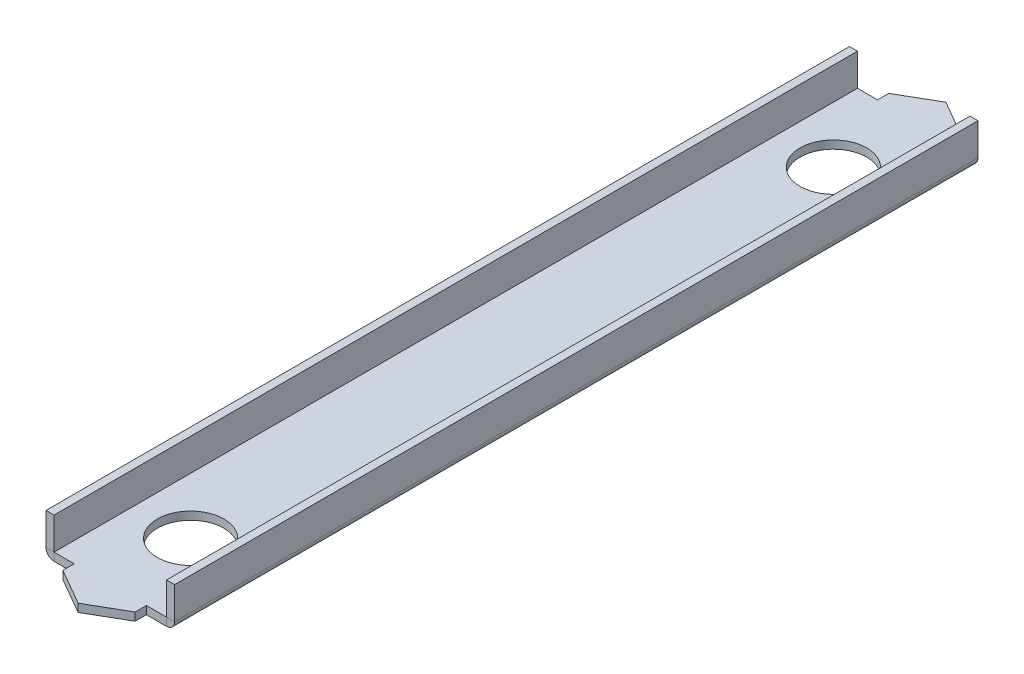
SolidWorks part; units mm, degrees
ref_plane "Plan1" through (0, 0, 0) normal (0, 0, 1) x (1, 0, 0)
ref_plane "Plan2" through (0, 0, 0) normal (0, 1, 0) x (1, 0, 0)
ref_plane "Plan3" through (0, 0, 0) normal (1, 0, 0) x (0, 0, -1)
sketch "Esquisse1" plane through (0, 0, 0) normal (0, 0, 1) x (1, 0, 0)
  line L0 (-8, 0) -> (8, 0)
  line L1 (8, 0) -> (8, 5)
  line L2 (0, 30) -> (0, -30) construction
  line L3 (-8, 0) -> (-8, 5)
  point P7 (0, 0)
  dimension "D1" = 16
  dimension "D2" = 5
extrude "Base-Extru.-Mince" add sketch "Esquisse1" along normal mid plane 110 thin
sheet metal parameters "Tôlerie 1" parameters "D1"=0
bend "Pli dans angle2" bend angle 90 parameters "D1"=0, "D5"=1
flatten bends "Dépliage 1" parameters "D1"=0
sketch "Esquisse-Angle1" plane through (0, 1, 0) normal (0, 1, 0) x (-1, 0, 0)
  line L0 (-7.3927, 55) -> (-7.3927, -55) construction
  line L1 (7.3927, -55) -> (7.3927, 55) construction
bend "Pli dans angle1" bend angle 90 parameters "D1"=0, "D5"=2
sketch "Esquisse5" plane through (0, 0, 0) normal (0, 1, 0) x (1, 0, 0)
  line L0 (51, 0) -> (-54, 0) construction
  line L1 (0, 70) -> (0, -47) construction
  line L2 (0, 54) -> (4.5, 51.4019)
  line L3 (4.5, 51.4019) -> (4.5, 50)
  line L4 (4.5, 50) -> (11.7854, 50)
  line L5 (11.7854, -55) -> (11.7854, 55) construction
  line L6 (11.7854, 50) -> (11.7854, 55)
  line L7 (11.7854, 55) -> (-11.7854, 55)
  line L8 (-4.5, 51.4019) -> (-4.5, 50)
  line L9 (0, 54) -> (-4.5, 51.4019)
  line L10 (-11.7854, 50) -> (-11.7854, 55)
  line L11 (-4.5, 50) -> (-11.7854, 50)
  line L12 (-11.7854, -55) -> (-11.7854, 55) construction
  line L13 (0, -54) -> (4.5, -51.4019)
  line L14 (4.5, -51.4019) -> (4.5, -50)
  line L15 (0, -54) -> (-4.5, -51.4019)
  line L16 (-4.5, -51.4019) -> (-4.5, -50)
  line L17 (-4.5, -50) -> (-11.7854, -50)
  line L18 (-11.7854, -50) -> (-11.7854, -55)
  line L19 (11.7854, -55) -> (-11.7854, -55)
  line L20 (11.7854, -50) -> (11.7854, -55)
  line L21 (4.5, -50) -> (11.7854, -50)
  circle A0 centre (0, 40) radius 4.15
  circle A1 centre (0, -40) radius 4.15
  point P21 (0, 55)
  dimension "D1" = 8.3
  dimension "D2" = 40
  dimension "D3" = 1
  dimension "D4" = 4
  dimension "D5" = 4.5
  dimension "D6" = 60
extrude "Enlèv. mat.-Extru.4" cut sketch "Esquisse5" along normal up to next
process bends "Pliage 1" parameters "D1"=0
sketch "Esquisse-Plate1" plane through (0, 1, 0) normal (0, 1, 0) x (-1, 0, 0)
